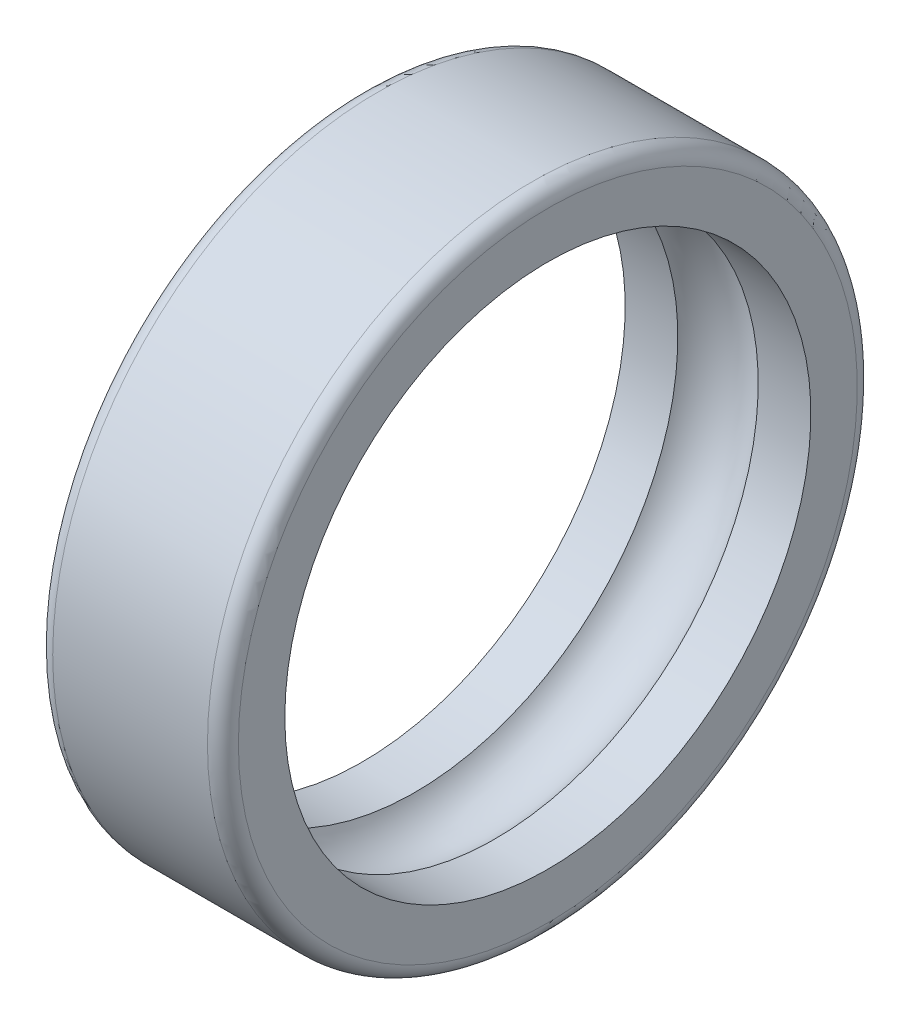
SolidWorks part; units mm, degrees
ref_plane "Plan1" through (0, 0, 0) normal (0, 0, 1) x (1, 0, 0)
ref_plane "Plan2" through (0, 0, 0) normal (0, 1, 0) x (1, 0, 0)
ref_plane "Plan3" through (0, 0, 0) normal (1, 0, 0) x (0, 0, -1)
sketch "Esquisse1" plane through (0, 0, 0) normal (0, 0, 1) x (1, 0, 0)
  line L0 (4, 97.5) -> (-6, 97.5) construction
  line L1 (-7, 104.5) -> (-3.5981, 104.5)
  line L2 (-7, 104.5) -> (-7, 107.5)
  line L3 (-6, 108.5) -> (4, 108.5)
  line L4 (5, 104.5) -> (5, 107.5)
  line L5 (-7, 101.5) -> (-7, 73.5) construction
  line L6 (-1, 107.6735) -> (-1, 98.3304) construction
  line L7 (1.5981, 104.5) -> (5, 104.5)
  line L8 (-11.1893, 87.5) -> (13.1731, 87.5) construction
  arc A0 (4, 108.5) -> (5, 107.5) centre (4, 107.5) cw
  arc A1 (-7, 107.5) -> (-6, 108.5) centre (-6, 107.5) cw
  arc A2 (1.5981, 104.5) -> (-3.5981, 104.5) centre (-1, 103) ccw
  circle A4 centre (-1, 103) radius 3 construction
  point P8 (5, 108.5)
  point P11 (-7, 108.5)
  dimension "D4" = 1
  dimension "D1" = 12
  dimension "D2" = 4
  dimension "D3" = 11
  dimension "D5" = 21
revolve "Base-Révolution" add sketch "Esquisse1" angle 360 about L8
